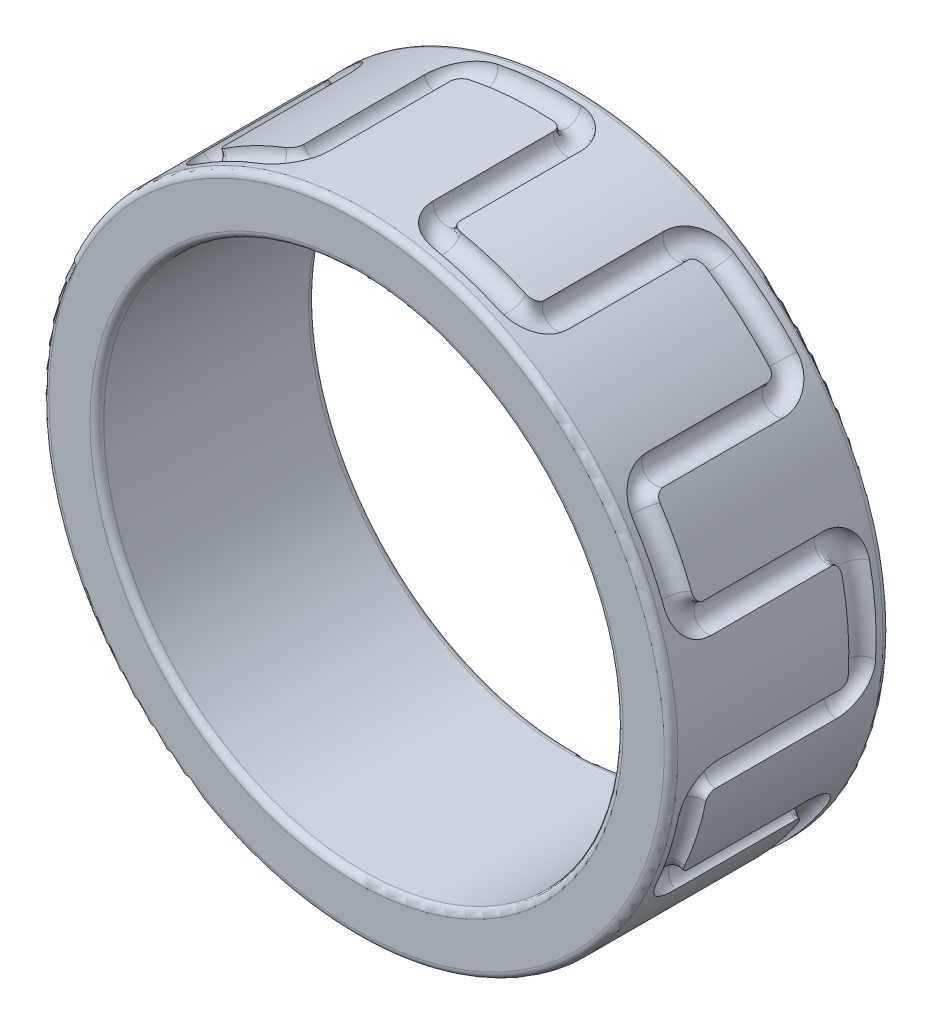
SolidWorks part; units mm, degrees
ref_plane "Vorder" through (0, 0, 0) normal (0, 0, 1) x (1, 0, 0)
ref_plane "Drauf" through (0, 0, 0) normal (0, 1, 0) x (1, 0, 0)
ref_plane "Seite" through (0, 0, 0) normal (1, 0, 0) x (0, 0, -1)
sketch "Sketch1" plane through (0, 0, 0) normal (0, 0, 1) x (1, 0, 0)
  circle A0 centre (0, 0) radius 11.5
  circle A1 centre (0, 0) radius 9.5
  circle A2 centre (0, 0) radius 11.5 construction
  dimension "D2" = 2
extrude "Extrude1" add sketch "Sketch1" along normal blind 8
other "Cavity1"
other "Ring_meander<1>@Ring1"
fillet "Fillet1" radius 0.25 4 edges at (11.5, 0, 0) (11.5, 0, 8) (9.5, 0, 0) (9.5, 0, 8)
